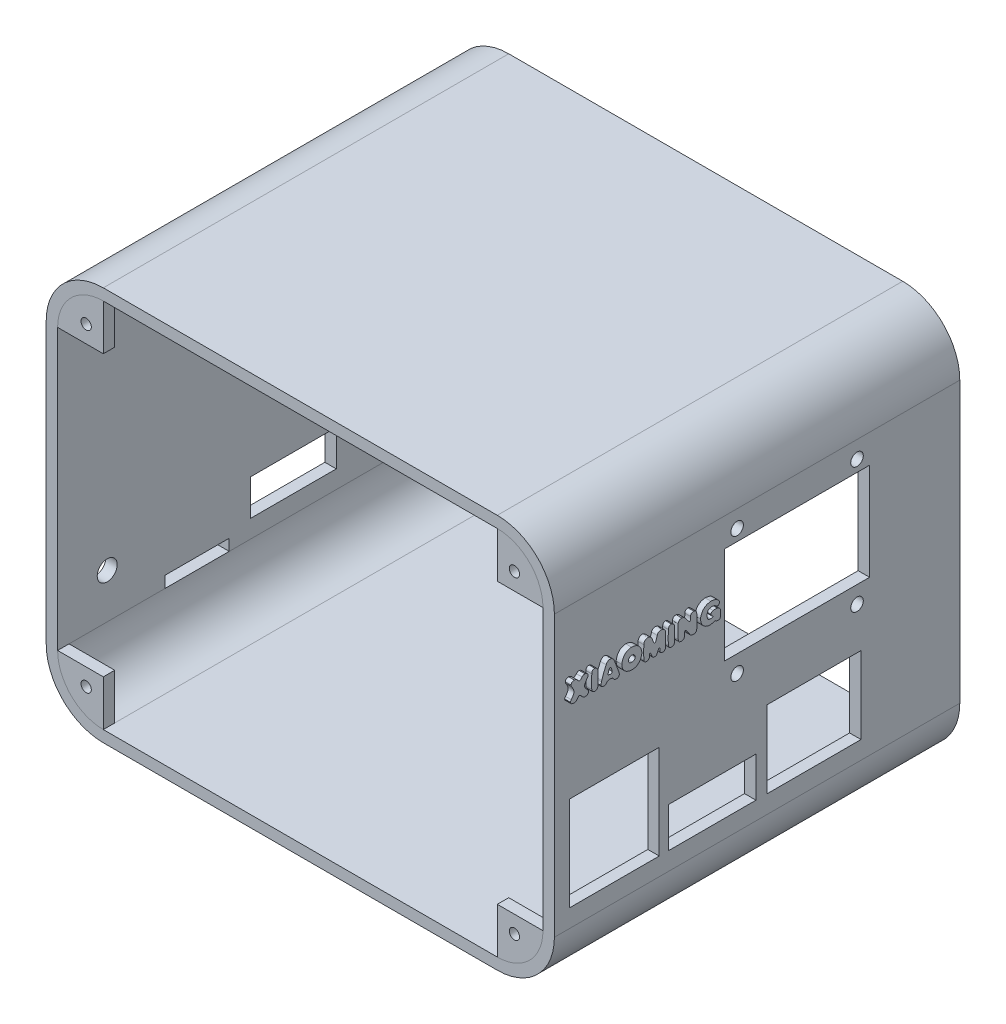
SolidWorks part; units mm, degrees
ref_plane "前视基准面" through (0, 0, 0) normal (0, 0, 1) x (1, 0, 0)
ref_plane "上视基准面" through (0, 0, 0) normal (0, 1, 0) x (1, 0, 0)
ref_plane "右视基准面" through (0, 0, 0) normal (1, 0, 0) x (0, 0, -1)
sketch "草图1" plane through (0, 0, 0) normal (0, 0, 1) x (1, 0, 0)
  line L0 (8, 67) -> (77, 67)
  line L1 (8, 0) -> (77, 0)
  line L2 (0, 8) -> (0, 57)
  line L3 (8, 65) -> (77, 65)
  line L4 (85, 8) -> (85, 57)
  line L5 (87, 8) -> (87, 57)
  line L6 (8, -2) -> (77, -2)
  line L7 (-2, 8) -> (-2, 57)
  arc A0 (77, 0) -> (85, 8) centre (77, 8) ccw
  arc A1 (0, 57) -> (8, 65) centre (8, 57) cw
  arc A2 (77, 65) -> (85, 57) centre (77, 57) cw
  arc A3 (8, 0) -> (0, 8) centre (8, 8) cw
  arc A4 (77, 67) -> (87, 57) centre (77, 57) cw
  arc A5 (77, -2) -> (87, 8) centre (77, 8) ccw
  arc A6 (8, -2) -> (-2, 8) centre (8, 8) cw
  arc A7 (-2, 57) -> (8, 67) centre (8, 57) cw
  point P7 (85, 0)
  point P12 (85, 65)
  point P15 (0, 0)
  dimension "D3" = 8
  dimension "D1" = 85
  dimension "D2" = 65
  dimension "D4" = 2
extrude "凸台-拉伸1" add sketch "草图1" against normal blind 71
sketch "草图2" plane through (0, 0, 0) normal (0, 0, 1) x (1, 0, 0)
  line L0 (8, 65) -> (8, 57)
  line L1 (8, 57) -> (0, 57)
  line L2 (42.5, 65) -> (42.5, 0) construction
  line L3 (77, 65) -> (8, 65) construction
  line L4 (8, 0) -> (77, 0) construction
  line L5 (0, 32.5) -> (85, 32.5)
  line L6 (0, 57) -> (0, 8) construction
  line L7 (85, 8) -> (85, 57) construction
  line L8 (77, 57) -> (85, 57)
  line L9 (77, 65) -> (77, 57)
  line L10 (77, 0) -> (77, 8)
  line L11 (77, 8) -> (85, 8)
  line L12 (8, 8) -> (0, 8)
  line L13 (8, 0) -> (8, 8)
  circle A0 centre (5, 60) radius 0.9
  circle A1 centre (80, 60) radius 0.9
  circle A2 centre (80, 5) radius 0.9
  circle A3 centre (5, 5) radius 0.9
  dimension "D1" = 1.8
  dimension "D2" = 3
  dimension "D3" = 3
extrude "凸台-拉伸2" add sketch "草图2" against normal blind 2 separate body contours L1 L0 A0 M10 | L9 L8 A1 M12 | L13 L12 A3 M8 | L11 L10 A2 M6
sketch "草图3" plane through (0, 0, -71) normal (0, 0, -1) x (-1, 0, 0)
  line L0 (-77, 65) -> (-77, 57)
  line L1 (-77, 57) -> (-85, 57)
  line L2 (-42.5, 65) -> (-42.5, 0) construction
  line L5 (-85, 32.5) -> (0, 32.5) construction
  line L6 (-85, 8) -> (-85, 57) construction
  line L7 (0, 57) -> (0, 8) construction
  line L8 (-77, 65) -> (-8, 65) construction
  line L9 (-8, 0) -> (-77, 0) construction
  line L10 (-8, 57) -> (0, 57)
  line L11 (-8, 65) -> (-8, 57)
  line L12 (-8, 8) -> (0, 8)
  line L13 (-8, 0) -> (-8, 8)
  line L14 (-77, 8) -> (-85, 8)
  line L15 (-77, 0) -> (-77, 8)
  circle A0 centre (-80, 60) radius 0.9
  circle A2 centre (-5, 60) radius 0.9
  circle A3 centre (-5, 5) radius 0.9
  circle A4 centre (-80, 5) radius 0.9
extrude "凸台-拉伸3" add sketch "草图3" against normal blind 2 contours L1 L0 A0 M9 | L11 L10 A2 M11 | L13 L12 A3 M13 | L15 L14 A4 M7
sketch "草图5" plane through (87, 0, 0) normal (1, 0, 0) x (0, 0, -1)
  line L4 (2.66, 27.14) -> (17.86, 27.14)
  line L5 (2.66, 27.14) -> (2.66, 11.14)
  line L6 (2.66, 11.14) -> (17.86, 11.14)
  line L7 (17.86, 27.14) -> (17.86, 11.14)
  line L8 (20.5, 17.64) -> (35.3, 17.64)
  line L9 (20.5, 17.64) -> (20.5, 11.14)
  line L10 (20.5, 11.14) -> (35.3, 11.14)
  line L11 (35.3, 17.64) -> (35.3, 11.14)
  line L12 (37.2, 24.14) -> (53.2, 24.14)
  line L13 (37.2, 24.14) -> (37.2, 11.14)
  line L14 (37.2, 11.14) -> (53.2, 11.14)
  line L15 (53.2, 24.14) -> (53.2, 11.14)
extrude "切除-拉伸1" cut sketch "草图5" against normal up to next (2 mm away)
sketch "草图6" plane through (-2, 0, 0) normal (-1, 0, 0) x (0, 0, 1)
  line L4 (-48.8, 17.44) -> (-33.8, 17.44)
  line L5 (-48.8, 17.44) -> (-48.8, 11.14)
  line L6 (-48.8, 11.14) -> (-33.8, 11.14)
  line L7 (-33.8, 17.44) -> (-33.8, 11.14)
  line L8 (-30.0532, 10) -> (-18.8, 10)
  line L9 (-30.0532, 10) -> (-30.0532, 8)
  line L10 (-30.0532, 8) -> (-18.8, 8)
  line L11 (-18.8, 10) -> (-18.8, 8)
extrude "切除-拉伸2" cut sketch "草图6" against normal up to next (2 mm away)
sketch "草图7" plane through (87, 0, 0) normal (1, 0, 0) x (0, 0, -1)
  line L0 (2.66, 27.14) -> (2.66, 11.14) construction
  line L1 (2.66, 27.64) -> (18.36, 27.64)
  line L2 (2.66, 27.64) -> (2.66, 11.14)
  line L3 (2.66, 11.14) -> (18.36, 11.14)
  line L4 (18.36, 27.64) -> (18.36, 11.14)
  line L5 (17.86, 27.14) -> (2.66, 27.14) construction
  line L6 (17.86, 11.14) -> (17.86, 27.14) construction
  line L7 (35.3, 17.64) -> (20.5, 17.64) construction
  line L8 (35.3, 11.14) -> (20, 11.14)
  line L9 (35.3, 11.14) -> (35.3, 18.14)
  line L10 (35.3, 18.14) -> (20, 18.14)
  line L11 (20, 11.14) -> (20, 18.14)
  line L12 (37.2, 11.14) -> (53.7, 11.14)
  line L13 (37.2, 11.14) -> (37.2, 24.64)
  line L14 (37.2, 24.64) -> (53.7, 24.64)
  line L15 (53.7, 11.14) -> (53.7, 24.64)
  line L16 (20.5, 17.64) -> (20.5, 11.14) construction
  line L17 (53.2, 24.14) -> (37.2, 24.14) construction
  line L18 (53.2, 11.14) -> (53.2, 24.14) construction
  point P28 (53.2, 17.64)
  dimension "D1" = 0.5
  dimension "D2" = 0.5
  dimension "D3" = 0.5
  dimension "D4" = 0.5
  dimension "D5" = 0.5
  dimension "D6" = 0.5
extrude "切除-拉伸3" cut sketch "草图7" against normal up to next (87 mm away)
sketch "草图9" plane through (87, 0, 0) normal (1, 0, 0) x (0, 0, -1)
  line L0 (0, 8) -> (0, 57) construction
  line L1 (71, 57) -> (0, 57) construction
  line L3 (29.8, 52) -> (55.2, 52)
  line L4 (29.8, 52) -> (29.8, 35)
  line L5 (29.8, 35) -> (55.2, 35)
  line L6 (55.2, 52) -> (55.2, 35)
  circle A0 centre (32, 54) radius 1.1
  circle A1 centre (53, 54) radius 1.1
  circle A2 centre (32, 32) radius 1.1
  circle A3 centre (53, 32) radius 1.1
  dimension "D1" = 2.2
  dimension "D2" = 2.2
  dimension "D3" = 2.2
  dimension "D4" = 21
  dimension "D5" = 22
  dimension "D6" = 32
  dimension "D7" = 3
  dimension "D10" = 2.2
  dimension "D11" = 2
  dimension "D12" = 2.2
  dimension "D8" = 25.4
  dimension "D9" = 17
extrude "切除-拉伸4" cut sketch "草图9" against normal up to next (2 mm away)
sketch "草图10" plane through (87, 0, 0) normal (1, 0, 0) x (0, 0, -1)
  text T0 "XIAOMING" font "华光胖头鱼_CNKI" height 3.5
extrude "凸台-拉伸4" add sketch "草图10" along normal blind 1
sketch "草图11" plane through (-2, 0, 0) normal (-1, 0, 0) x (0, 0, 1)
  circle A0 centre (-8.6848, 15.8133) radius 1.75
  dimension "D1" = 3.5
extrude "切除-拉伸5" cut sketch "草图11" against normal up to next (2 mm away)
